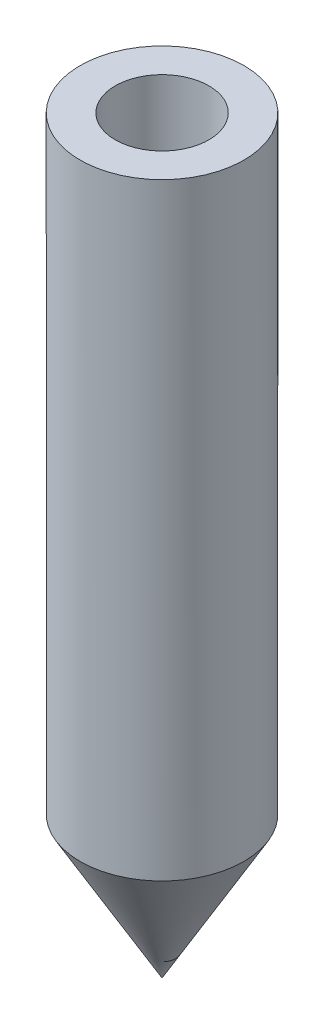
SolidWorks part; units mm, degrees
ref_plane "Front Plane" through (0, 0, 0) normal (0, 0, 1) x (1, 0, 0)
ref_plane "Top Plane" through (0, 0, 0) normal (0, 1, 0) x (1, 0, 0)
ref_plane "Right Plane" through (0, 0, 0) normal (1, 0, 0) x (0, 0, -1)
sketch "Sketch1" plane through (0, 0, 0) normal (0, 1, 0) x (1, 0, 0)
  circle A0 centre (0, 0) radius 2.0828
  dimension "D1" = 4.1656
extrude "Boss-Extrude1" add sketch "Sketch1" along normal blind 19.05
chamfer "Chamfer1" distance 2.0828 angle 60 1 edges at (0, 0, 2.0828)
sketch "Sketch4" plane through (0, 19.05, 0) normal (0, 1, 0) x (1, 0, 0)
  circle A0 centre (0, 0) radius 1.1906
  dimension "D1" = 2.3813
extrude "Cut-Extrude1" cut sketch "Sketch4" against normal blind 3.175
chamfer "Chamfer2" distance 1.1906 angle 45 1 edges at (0, 15.875, 1.1906)
